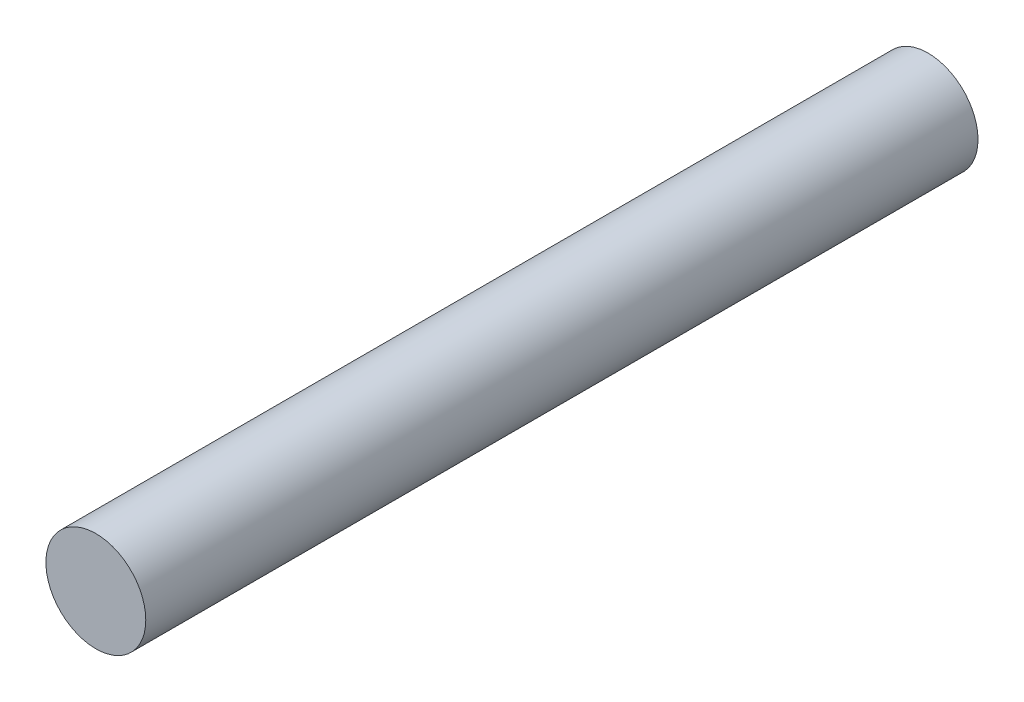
SolidWorks part; units mm, degrees
ref_plane "Plan de face" through (0, 0, 0) normal (0, 0, 1) x (1, 0, 0)
ref_plane "Plan de dessus" through (0, 0, 0) normal (0, 1, 0) x (1, 0, 0)
ref_plane "Plan de droite" through (0, 0, 0) normal (1, 0, 0) x (0, 0, -1)
sketch "Esquisse1" plane through (0, 0, 0) normal (0, 0, 1) x (1, 0, 0)
  circle A0 centre (0, 0) radius 1.5
  dimension "D1" = 3
extrude "Boss.-Extru.1" add sketch "Esquisse1" along normal blind 25
